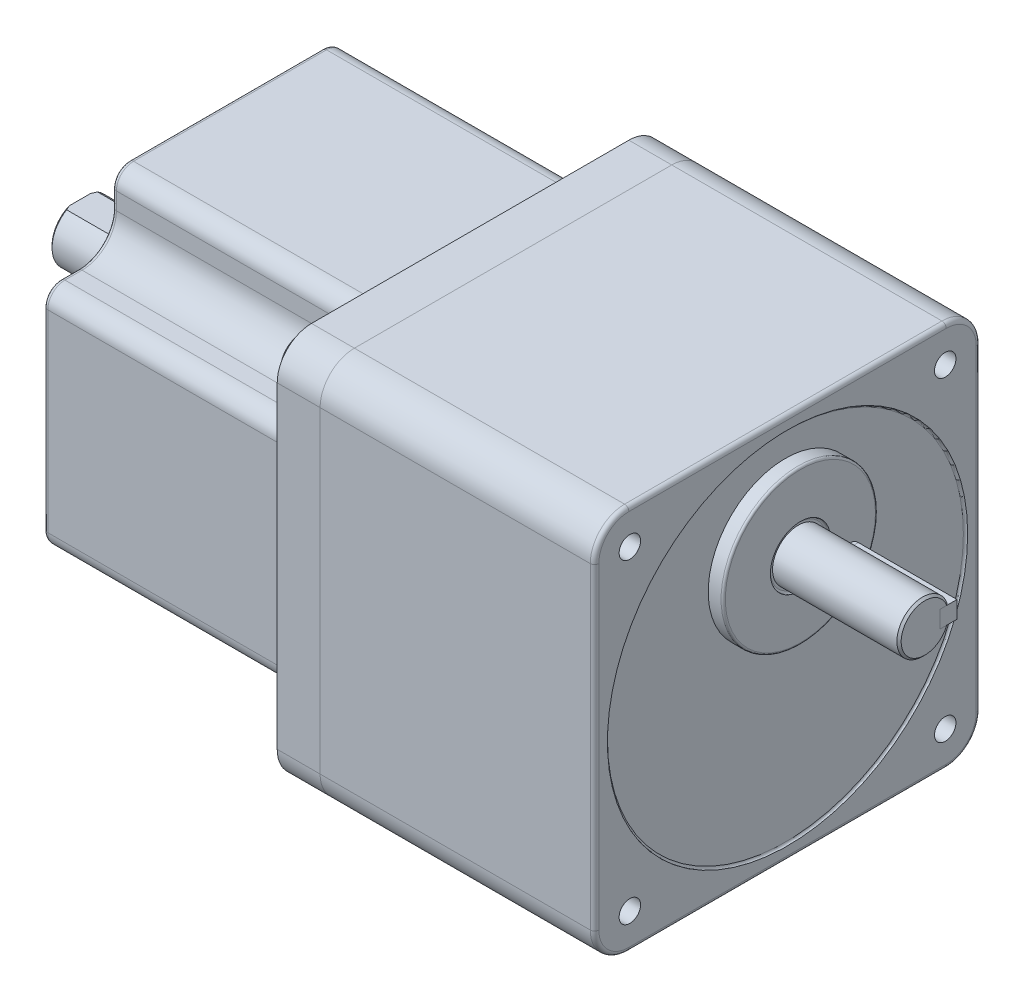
SolidWorks part; units mm, degrees
ref_plane "前视基准面" through (0, 0, 0) normal (0, 0, 1) x (1, 0, 0)
ref_plane "上视基准面" through (0, 0, 0) normal (0, 1, 0) x (1, 0, 0)
ref_plane "右视基准面" through (0, 0, 0) normal (1, 0, 0) x (0, 0, -1)
sketch "草图1" plane through (0, 0, 0) normal (1, 0, 0) x (0, 0, -1)
  line L1 (-37, -45) -> (37, -45)
  line L2 (-45, -37) -> (-45, 37)
  line L3 (-37, 45) -> (37, 45)
  line L4 (45, -37) -> (45, 37)
  line L5 (-45, -45) -> (45, 45) construction
  line L6 (-45, 45) -> (45, -45) construction
  arc A0 (37, 45) -> (45, 37) centre (37, 37) cw
  arc A1 (37, -45) -> (45, -37) centre (37, -37) ccw
  arc A2 (-37, -45) -> (-45, -37) centre (-37, -37) cw
  arc A3 (-45, 37) -> (-37, 45) centre (-37, 37) cw
  point P0 (0, 0)
  dimension "D1" = 8
extrude "凸台-拉伸1" add sketch "草图1" against normal blind 64
sketch "草图2" plane through (-64, 0, 0) normal (-1, 0, 0) x (0, 0, 1)
  line L0 (-37, 45) -> (37, 45) construction
  line L1 (-37, -45) -> (37, -45)
  line L2 (-45, -37) -> (-45, 37)
  line L3 (-37, 45) -> (37, 45)
  line L4 (45, -37) -> (45, 37)
  line L5 (-45, -45) -> (45, 45) construction
  line L6 (-45, 45) -> (45, -45) construction
  arc A0 (37, 45) -> (45, 37) centre (37, 37) cw
  arc A1 (37, -45) -> (45, -37) centre (37, -37) ccw
  arc A2 (-37, -45) -> (-45, -37) centre (-37, -37) cw
  arc A3 (-45, 37) -> (-37, 45) centre (-37, 37) cw
  point P0 (0, 0)
  dimension "D1" = 8
extrude "凸台-拉伸2" add sketch "草图2" along normal blind 10 separate body
sketch "草图3" plane through (-74, 0, 0) normal (-1, 0, 0) x (0, 0, 1)
  line L1 (-34.5, -42.5) -> (34.5, -42.5)
  line L2 (-42.5, -34.5) -> (-42.5, 34.5)
  line L3 (-34.5, 42.5) -> (34.5, 42.5)
  line L4 (42.5, -34.5) -> (42.5, 34.5)
  line L5 (-42.5, -42.5) -> (42.5, 42.5) construction
  line L6 (-42.5, 42.5) -> (42.5, -42.5) construction
  arc A0 (34.5, -42.5) -> (42.5, -34.5) centre (34.5, -34.5) ccw
  arc A1 (-34.5, -42.5) -> (-42.5, -34.5) centre (-34.5, -34.5) cw
  arc A2 (-42.5, 34.5) -> (-34.5, 42.5) centre (-34.5, 34.5) cw
  arc A3 (34.5, 42.5) -> (42.5, 34.5) centre (34.5, 34.5) cw
  point P0 (0, 0)
  dimension "D1" = 8
extrude "凸台-拉伸3" add sketch "草图3" along normal blind 57
sketch "草图4" plane through (-131, 0, 0) normal (-1, 0, 0) x (0, 0, 1)
  line L0 (-34.5, 26.5) -> (-38.5, 26.5)
  line L1 (-42.5, 34.5) -> (-42.5, -34.5) construction
  line L3 (-42.5, 34.5) -> (-42.5, -34.5) construction
  line L4 (-38.5, -26.5) -> (-34.5, -26.5)
  line L6 (-26.5, -34.5) -> (-26.5, -38.5)
  line L7 (-34.5, -42.5) -> (34.5, -42.5) construction
  line L9 (26.5, -38.5) -> (26.5, -34.5)
  line L10 (-42.5, 22.5) -> (-42.5, 34.5)
  line L11 (34.5, -26.5) -> (38.5, -26.5)
  line L12 (42.5, -34.5) -> (42.5, 34.5) construction
  line L14 (34.5, 26.5) -> (38.5, 26.5)
  line L15 (42.5, -34.5) -> (42.5, 34.5) construction
  line L16 (-34.5, 42.5) -> (-22.5, 42.5)
  line L17 (26.5, 34.5) -> (26.5, 38.5)
  line L18 (34.5, 42.5) -> (-34.5, 42.5) construction
  line L20 (-26.5, 38.5) -> (-26.5, 34.5)
  line L21 (22.5, 42.5) -> (34.5, 42.5)
  line L23 (42.5, 34.5) -> (42.5, 22.5)
  line L24 (42.5, -22.5) -> (42.5, -34.5)
  line L26 (34.5, -42.5) -> (22.5, -42.5)
  line L27 (22.5, -42.5) -> (22.7685, -42.6352)
  line L28 (-34.5, -42.5) -> (-22.5, -42.5)
  line L29 (-42.5, -34.5) -> (-42.5, -22.5)
  arc A0 (-34.5, 26.5) -> (-26.5, 34.5) centre (-34.5, 34.5) ccw
  arc A1 (26.5, 34.5) -> (34.5, 26.5) centre (34.5, 34.5) ccw
  arc A2 (34.5, -26.5) -> (26.5, -34.5) centre (34.5, -34.5) ccw
  arc A3 (-26.5, -34.5) -> (-34.5, -26.5) centre (-34.5, -34.5) ccw
  arc A4 (-42.5, -22.5) -> (-38.5, -26.5) centre (-38.5, -22.5) ccw
  arc A5 (-26.5, -38.5) -> (-22.5, -42.5) centre (-22.5, -38.5) ccw
  arc A6 (22.5, -42.5) -> (26.5, -38.5) centre (22.5, -38.5) ccw
  arc A7 (38.5, -26.5) -> (42.5, -22.5) centre (38.5, -22.5) ccw
  arc A8 (38.5, 26.5) -> (42.5, 22.5) centre (38.5, 22.5) cw
  arc A9 (26.5, 38.5) -> (22.5, 42.5) centre (22.5, 38.5) ccw
  arc A10 (-22.5, 42.5) -> (-26.5, 38.5) centre (-22.5, 38.5) ccw
  arc A11 (-38.5, 26.5) -> (-42.5, 22.5) centre (-38.5, 22.5) ccw
  arc A12 (-34.5, 42.5) -> (-42.5, 34.5) centre (-34.5, 34.5) ccw
  arc A13 (42.5, 34.5) -> (34.5, 42.5) centre (34.5, 34.5) ccw
  arc A14 (-42.5, -34.5) -> (-34.5, -42.5) centre (-34.5, -34.5) ccw
  arc A15 (34.5, -26.5) -> (26.5, -34.5) centre (34.5, -34.5) ccw
  arc A16 (-26.5, -34.5) -> (-34.5, -26.5) centre (-34.5, -34.5) ccw
  arc A17 (34.5, -42.5) -> (42.5, -34.5) centre (34.5, -34.5) ccw
  arc A18 (26.5, 34.5) -> (34.5, 26.5) centre (34.5, 34.5) ccw
  arc A19 (-34.5, 26.5) -> (-26.5, 34.5) centre (-34.5, 34.5) ccw
  point P0 (0, 0)
  point P13 (-42.5, -26.5)
  point P43 (-26.5, -42.5)
  point P46 (26.5, -42.5)
  point P49 (42.5, -26.5)
  point P52 (42.5, 26.5)
  point P55 (26.5, 42.5)
  point P58 (-26.5, 42.5)
  point P61 (-42.5, 26.5)
  dimension "D1" = 4
extrude "切除-拉伸1" cut sketch "草图4" against normal blind 57 contours A11 L0 A0 L20 A10 M4 M5 M6 | A9 L17 A1 L14 A8 M2 M3 M4 | A7 L11 A2 L9 A6 M8 M1 M2 | A5 L6 A3 L4 A4 M6 M7 M8
fillet "圆角1" radius 1 24 edges at (-131, -28.8431, -28.8431) (-131, -26.5, -36.5) (-131, -25.3284, -41.3284) (-131, 0, -42.5) (-131, 25.3284, -41.3284) (-131, 26.5, -36.5) (-131, 28.8431, -28.8431) (-131, 36.5, -26.5) (-131, 41.3284, -25.3284) (-131, 42.5, 0) (-131, 41.3284, 25.3284) (-131, 36.5, 26.5) (-131, 28.8431, 28.8431) (-131, 26.5, 36.5) (-131, 25.3284, 41.3284) (-131, 0, 42.5) (-131, -25.3284, 41.3284) (-131, -26.5, 36.5) (-131, -28.8431, 28.8431) (-131, -36.5, 26.5) (-131, -41.3284, 25.3284) (-131, -42.5, 0) (-131, -41.3284, -25.3284) (-131, -36.5, -26.5)
sketch "草图5" plane through (-74, 0, 0) normal (-1, 0, 0) x (0, 0, 1)
  circle A0 centre (-34.5, 34.5) radius 5
  circle A1 centre (34.5, 34.5) radius 5
  circle A2 centre (34.5, -34.5) radius 5
  circle A3 centre (-34.5, -34.5) radius 5
extrude "凸台-拉伸4" add sketch "草图5" along normal blind 5
sketch "草图6" plane through (-79, 0, 0) normal (-1, 0, 0) x (0, 0, 1)
  line L1 (-31.3246, 34.5) -> (-32.9123, 37.25)
  line L2 (-32.9123, 37.25) -> (-36.0877, 37.25)
  line L3 (-36.0877, 37.25) -> (-37.6754, 34.5)
  line L4 (-37.6754, 34.5) -> (-36.0877, 31.75)
  line L5 (-36.0877, 31.75) -> (-32.9123, 31.75)
  line L6 (-32.9123, 31.75) -> (-31.3246, 34.5)
  line L7 (37.6754, 34.5) -> (36.0877, 37.25)
  line L8 (36.0877, 37.25) -> (32.9123, 37.25)
  line L9 (32.9123, 37.25) -> (31.3246, 34.5)
  line L10 (31.3246, 34.5) -> (32.9123, 31.75)
  line L11 (32.9123, 31.75) -> (36.0877, 31.75)
  line L12 (36.0877, 31.75) -> (37.6754, 34.5)
  line L13 (37.6754, -34.5) -> (36.0877, -31.75)
  line L14 (36.0877, -31.75) -> (32.9123, -31.75)
  line L15 (32.9123, -31.75) -> (31.3246, -34.5)
  line L16 (31.3246, -34.5) -> (32.9123, -37.25)
  line L17 (32.9123, -37.25) -> (36.0877, -37.25)
  line L18 (36.0877, -37.25) -> (37.6754, -34.5)
  line L19 (-31.3246, -34.5) -> (-32.9123, -31.75)
  line L20 (-32.9123, -31.75) -> (-36.0877, -31.75)
  line L21 (-36.0877, -31.75) -> (-37.6754, -34.5)
  line L22 (-37.6754, -34.5) -> (-36.0877, -37.25)
  line L23 (-36.0877, -37.25) -> (-32.9123, -37.25)
  line L24 (-32.9123, -37.25) -> (-31.3246, -34.5)
  circle A0 centre (-34.5, 34.5) radius 2.75 construction
  circle A1 centre (34.5, 34.5) radius 2.75 construction
  circle A2 centre (34.5, -34.5) radius 2.75 construction
  circle A3 centre (-34.5, -34.5) radius 2.75 construction
extrude "切除-拉伸2" cut sketch "草图6" against normal blind 1.5
chamfer "倒角1" distance 0.3 angle 45 28 edges at (-79, -34.5, -29.5) (-79, -33.125, -32.1184) (-79, -31.75, -34.5) (-79, -33.125, -36.8816) (-79, -35.875, -36.8816) (-79, -37.25, -34.5) (-79, -35.875, -32.1184) (-79, -34.5, 39.5) (-79, -33.125, 36.8816) (-79, -31.75, 34.5) (-79, -33.125, 32.1184) (-79, -35.875, 32.1184) (-79, -37.25, 34.5) (-79, -35.875, 36.8816) (-79, 34.5, 39.5) (-79, 35.875, 36.8816) (-79, 37.25, 34.5) (-79, 35.875, 32.1184) (-79, 33.125, 32.1184) (-79, 31.75, 34.5) (-79, 33.125, 36.8816) (-79, 34.5, -29.5) (-79, 35.875, -32.1184) (-79, 37.25, -34.5) (-79, 35.875, -36.8816) (-79, 33.125, -36.8816) (-79, 31.75, -34.5) (-79, 33.125, -32.1184)
sketch "草图7" plane through (-131, 0, 0) normal (-1, 0, 0) x (0, 0, 1)
  circle A0 centre (0, 0) radius 7
extrude "凸台-拉伸5" add sketch "草图7" along normal blind 34
sketch "草图8" plane through (-165, 0, 0) normal (-1, 0, 0) x (0, 0, 1)
  line L3 (-6, 3.6056) -> (-6, -3.6056)
  line L5 (3.6056, 6) -> (-3.6056, 6)
  arc A0 (-6, 3.6056) -> (-6, -3.6056) centre (0, 0) ccw
  arc A1 (3.6056, 6) -> (-3.6056, 6) centre (0, 0) ccw
extrude "切除-拉伸3" cut sketch "草图8" against normal blind 25
chamfer "倒角2" distance 0.5 angle 45 2 edges at (-165, 4.9497, -4.9497) (-165, -4.9497, 4.9497)
sketch "草图9" plane through (0, 0, 0) normal (1, 0, 0) x (0, 0, -1)
  point P19 (-36.7696, 36.7696)
  point P20 (36.7696, 36.7696)
  point P21 (36.7696, -36.7696)
  point P22 (-36.7696, -36.7696)
hole_wizard "M6 螺纹孔1" positions "3D草图1" profile "草图10" tap size "M6" standard "GB"
sketch3d "3D草图1"
  point P0 (0, 36.7696, 36.7696)
  point P3 (0, -36.7696, 36.7696)
  point P6 (0, -36.7696, -36.7696)
  point P9 (0, 36.7696, -36.7696)
sketch "草图10" plane through (0, 36.7696, 36.7696) normal (0, 1, 0) x (0, 0, -1)
  line L0 (0, 0) -> (0, 18.5022)
  line L1 (0, 18.5022) -> (2.5, 17)
  line L2 (2.5, 17) -> (2.5, 0)
  line L5 (2.5, 0) -> (0, 0)
  line L10 (0, 18.5022) -> (-2.5, 17) construction
  line L11 (0, -6.35) -> (0, 107.95) construction
  dimension "螺纹孔钻头直径" = 5
  dimension "螺纹孔钻头深度" = 17
  dimension "导头角度" = 118
fillet "圆角2" radius 1 8 edges at (0, 42.6569, -42.6569) (0, 45, 0) (0, 42.6569, 42.6569) (0, 0, -45) (0, -42.6569, -42.6569) (0, -45, 0) (0, -42.6569, 42.6569) (0, 0, 45)
sketch "草图11" plane through (0, 0, 0) normal (1, 0, 0) x (0, 0, -1)
  circle A0 centre (0, 0) radius 42
extrude "切除-拉伸4" cut sketch "草图11" against normal blind 0.5
fillet "圆角3" radius 0.5 1 edges at (-0.5, 0, -42)
sketch "草图12" plane through (-0.5, 0, 0) normal (1, 0, 0) x (0, 0, -1)
  circle A0 centre (0, 18) radius 18
extrude "凸台-拉伸6" add sketch "草图12" along normal blind 3.5
fillet "圆角4" radius 0.5 1 edges at (3, 18, -18)
sketch "草图13" plane through (3, 0, 0) normal (1, 0, 0) x (0, 0, -1)
  circle A0 centre (0, 18) radius 7
extrude "切除-拉伸5" cut sketch "草图13" against normal blind 0.5
fillet "圆角5" radius 0.5 1 edges at (2.5, 18, -7)
sketch "草图14" plane through (2.5, 0, 0) normal (1, 0, 0) x (0, 0, -1)
  circle A0 centre (0, 18) radius 6
extrude "凸台-拉伸7" add sketch "草图14" along normal blind 29.5
ref_plane "基准面1" through (0, 0, -6) normal (0, 0, 1) x (1, 0, 0)
sketch "草图15" plane through (0, 0, -6) normal (0, 0, 1) x (1, 0, 0)
  line L1 (32, 12) -> (32, 24) construction
  line L2 (9, 20) -> (32, 20)
  line L3 (32, 20) -> (32, 16)
  line L4 (32, 16) -> (9, 16)
  arc A0 (9, 20) -> (9, 16) centre (9, 18) ccw
extrude "切除-拉伸6" cut sketch "草图15" along normal blind 2.5
sketch "草图16" plane through (0, 0, -3.5) normal (0, 0, -1) x (-1, 0, 0)
  line L0 (-9, 20) -> (-32, 20)
  line L1 (-32, 20) -> (-32, 16)
  line L2 (-32, 16) -> (-9, 16)
  arc A0 (-9, 16) -> (-9, 20) centre (-9, 18) ccw
extrude "凸台-拉伸8" add sketch "草图16" along normal blind 4 separate body
chamfer "倒角3" distance 0.5 angle 45 1 edges at (32, 18, 6)
